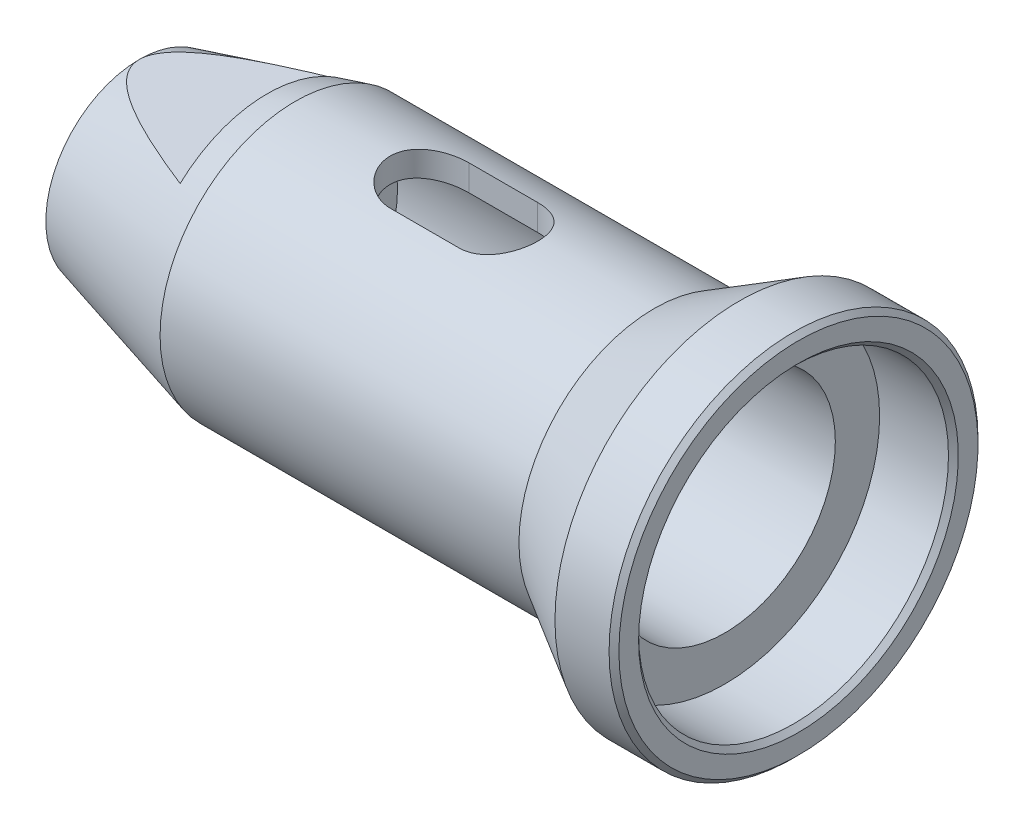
SolidWorks part; units mm, degrees
ref_plane "Plan de face" through (0, 0, 0) normal (0, 0, 1) x (1, 0, 0)
ref_plane "Plan de dessus" through (0, 0, 0) normal (0, 1, 0) x (1, 0, 0)
ref_plane "Plan de droite" through (0, 0, 0) normal (1, 0, 0) x (0, 0, -1)
sketch "Esquisse2" plane through (0, 0, 0) normal (0, 0, 1) x (1, 0, 0)
  line L0 (0, 0) -> (121.8315, 0) construction
  line L1 (0, 0) -> (0, 9.5)
  line L2 (0, 9.5) -> (15.8612, 13.75)
  line L3 (15.8612, 13.75) -> (52.3397, 13.75)
  line L4 (52.3397, 13.75) -> (61, 18.75)
  line L5 (61, 18.75) -> (67, 18.75)
  line L6 (67, 18.75) -> (67, 0)
  line L7 (67, 0) -> (0, 0)
  dimension "D1" = 19
  dimension "D2" = 27.5
  dimension "D3" = 37.5
  dimension "D4" = 67
  dimension "D5" = 6
  dimension "D6" = 15
  dimension "D7" = 30
revolve "Révolution1" add sketch "Esquisse2" angle 360 about L0
sketch "Esquisse4" plane through (67, 0, 0) normal (1, 0, 0) x (0, 0, -1)
  circle A0 centre (0, 0) radius 11.25
  circle A1 centre (0, 0) radius 18.75 construction
  dimension "D1" = 22.5
extrude "Enlèv. mat.-Extru.2" cut sketch "Esquisse4" against normal blind 52
sketch "Esquisse5" plane through (67, 0, 0) normal (1, 0, 0) x (0, 0, -1)
  circle A0 centre (0, 0) radius 15.75
  circle A3 centre (0, 0) radius 18.75 construction
  dimension "D1" = 31.5
extrude "Enlèv. mat.-Extru.3" cut sketch "Esquisse5" against normal blind 7.5
sketch "Esquisse7" plane through (0, 0, 0) normal (0, 0, 1) x (1, 0, 0)
  line L0 (0, 9.5) -> (0, -9.5) construction
  line L1 (0, 9.5) -> (13, 9.5)
  line L2 (0, 9.5) -> (0, 16.8638)
  line L3 (0, 16.8638) -> (13, 16.8638)
  line L4 (13, 9.5) -> (13, 16.8638)
  line L7 (0, -9.5) -> (13, -9.5)
  line L8 (0, -9.5) -> (0, -19.6718)
  line L9 (0, -19.6718) -> (13, -19.6718)
  line L10 (13, -9.5) -> (13, -19.6718)
  dimension "D2" = 13
  dimension "D3" = 19
  dimension "D4" = 9.5
  dimension "D5" = 13
extrude "Enlèv. mat.-Extru.5" cut sketch "Esquisse7" against normal through all and the other way through all
sketch "Esquisse9" plane through (0, 0, 0) normal (0, 1, 0) x (1, 0, 0)
  line L0 (15, 0) -> (59.5, 0) construction
  line L1 (67, -18.75) -> (67, 18.75) construction
  line L2 (36.5, 4) -> (29.5, 4)
  line L3 (36.5, -4) -> (29.5, -4)
  arc A0 (29.5, 4) -> (29.5, -4) centre (29.5, 0) ccw
  arc A1 (36.5, -4) -> (36.5, 4) centre (36.5, 0) ccw
  dimension "D1" = 8
  dimension "D3" = 8
  dimension "D2" = 37.5
  dimension "D4" = 7
extrude "Enlèv. mat.-Extru.6" cut sketch "Esquisse9" against normal through all and the other way through all
sketch "Esquisse10" plane through (0, 0, 0) normal (-1, 0, 0) x (0, 0, 1)
  circle A0 centre (0, 0) radius 8
  arc A1 (0, -9.5) -> (0, 9.5) centre (0, 0) ccw construction
  dimension "D1" = 16
extrude "Enlèv. mat.-Extru.7" cut sketch "Esquisse10" against normal through all
chamfer "Chanfrein2" distance 0.5 angle 45 4 edges at (0, 0, 8) (67, 0, 18.75) (67, 0, -15.75) (15, 0, -8)
